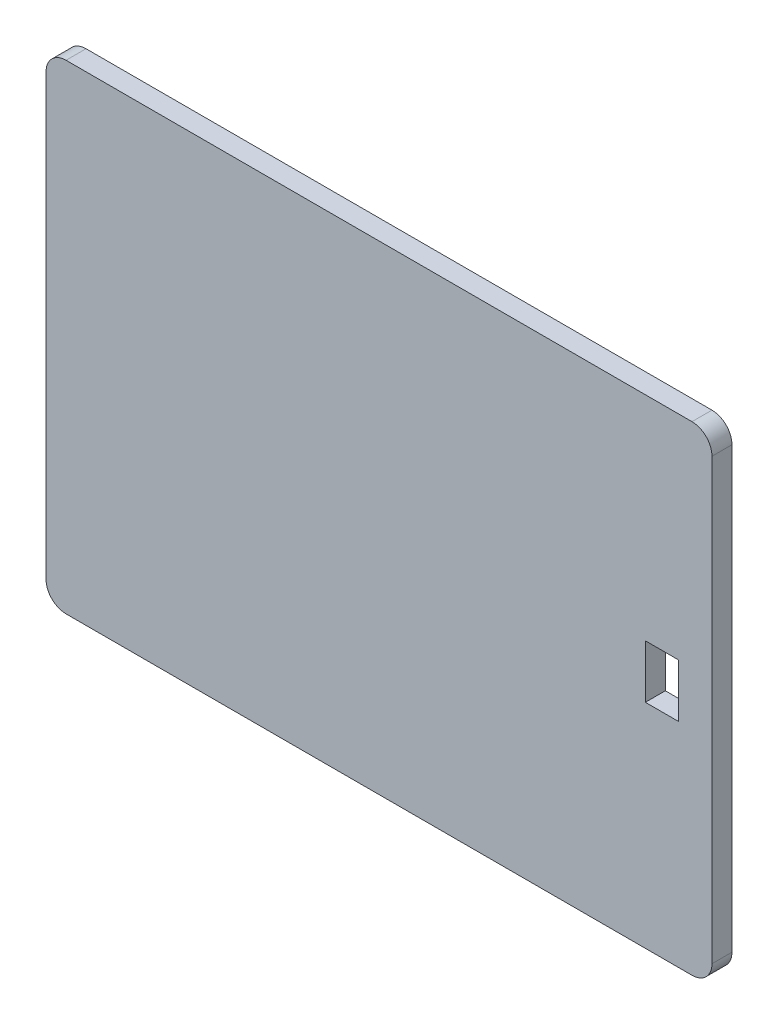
SolidWorks part; units mm, degrees
ref_plane "Plan de face" through (0, 0, 0) normal (0, 0, 1) x (1, 0, 0)
ref_plane "Plan de dessus" through (0, 0, 0) normal (0, 1, 0) x (1, 0, 0)
ref_plane "Plan de droite" through (0, 0, 0) normal (1, 0, 0) x (0, 0, -1)
sketch "Esquisse1" plane through (0, 0, 0) normal (0, 0, 1) x (1, 0, 0)
  line L1 (3, 0) -> (97, 0)
  line L2 (0, 3) -> (0, 69)
  line L3 (3, 72) -> (97, 72)
  line L4 (100, 3) -> (100, 69)
  arc A0 (3, 72) -> (0, 69) centre (3, 69) ccw
  arc A1 (100, 69) -> (97, 72) centre (97, 69) ccw
  arc A2 (97, 0) -> (100, 3) centre (97, 3) ccw
  arc A3 (0, 3) -> (3, 0) centre (3, 3) ccw
  point P7 (0, 72)
  point P10 (100, 72)
  point P15 (0, 0)
  dimension "D3" = 3
  dimension "D1" = 100
  dimension "D2" = 72
extrude "Extrusion1" add sketch "Esquisse1" along normal blind 3
sketch "Esquisse2" plane through (0, 0, 3) normal (0, 0, 1) x (1, 0, 0)
  line L0 (50, 72) -> (50, 0) construction
  line L1 (97, 72) -> (3, 72) construction
  line L2 (3, 0) -> (97, 0) construction
  line L3 (0, 36) -> (100, 36) construction
  line L5 (90, 40) -> (95, 40)
  line L6 (90, 40) -> (90, 32)
  line L7 (90, 32) -> (95, 32)
  line L8 (0, 69) -> (0, 3) construction
  line L9 (100, 3) -> (100, 69) construction
  line L10 (95, 40) -> (95, 32)
  dimension "D3" = 5
  dimension "D1" = 8
  dimension "D2" = 5
extrude "Enlèv. mat.-Extru.1" cut sketch "Esquisse2" against normal through all
